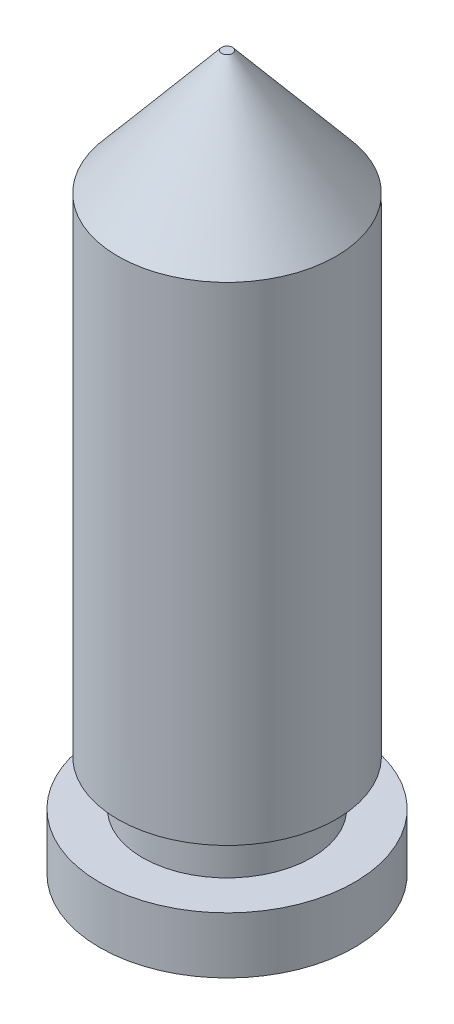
SolidWorks part; units mm, degrees
ref_plane "front" through (0, 0, 0) normal (0, 0, 1) x (1, 0, 0)
ref_plane "top" through (0, 0, 0) normal (0, 1, 0) x (1, 0, 0)
ref_plane "side" through (0, 0, 0) normal (1, 0, 0) x (0, 0, -1)
sketch "Sketch1" plane through (0, 0, 0) normal (0, 0, 1) x (1, 0, 0)
  line L0 (0, 0) -> (1.778, 0)
  line L1 (50, 0) -> (-50, 0) construction
  line L2 (1.778, 0) -> (1.778, 0.7874)
  line L3 (1.778, 0.7874) -> (1.1811, 0.7874)
  line L4 (1.1811, 0.7874) -> (1.1811, 1.4224)
  line L5 (1.1811, 1.4224) -> (1.524, 1.4224)
  line L6 (1.524, 1.4224) -> (1.524, 8.2296)
  line L7 (1.524, 8.2296) -> (0.0747, 9.9568)
  line L8 (0.0747, 9.9568) -> (0, 9.9568)
  line L9 (0, -50) -> (0, 50) construction
  line L10 (0, 9.9568) -> (0, 0)
  line L11 (0, 0) -> (0, -32.4919) construction
  point P15 (1.1811, 8.6552)
  dimension "D1" = 9.9568
  dimension "D2" = 0.7874
  dimension "D3" = 0.635
  dimension "D4" = 3.556
  dimension "D5" = 40
  dimension "D6" = 2.3622
  dimension "D7" = 3.048
  dimension "D8" = 1.7272
revolve "Revolve1" add sketch "Sketch1" angle 360 about L11
